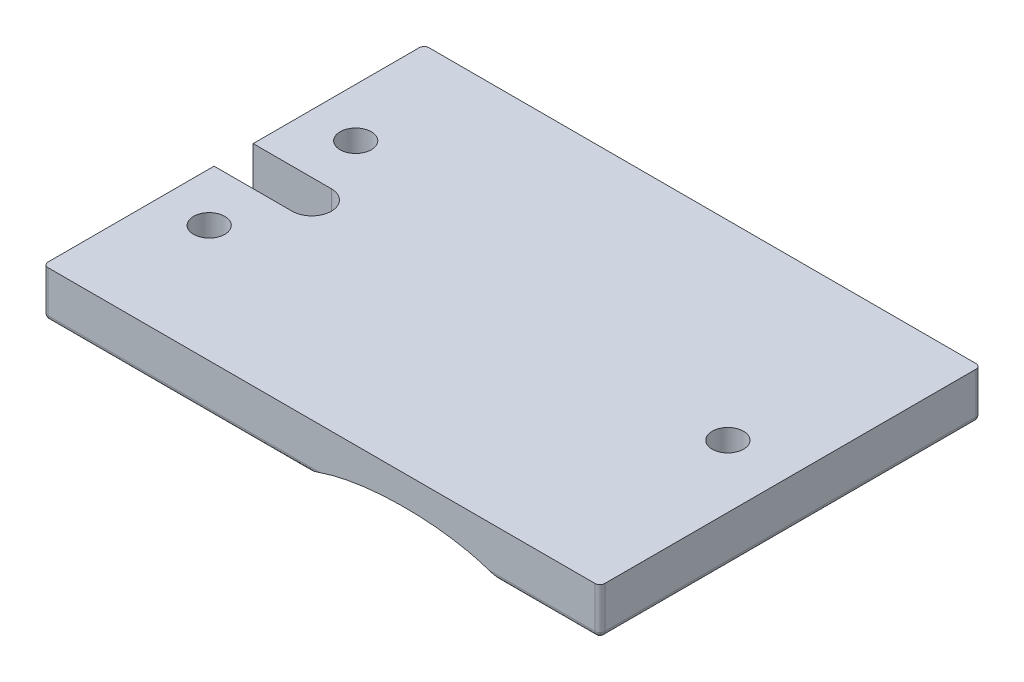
SolidWorks part; units mm, degrees
ref_plane "Front Plane" through (0, 0, 0) normal (0, 0, 1) x (1, 0, 0)
ref_plane "Top Plane" through (0, 0, 0) normal (0, 1, 0) x (1, 0, 0)
ref_plane "Right Plane" through (0, 0, 0) normal (1, 0, 0) x (0, 0, -1)
sketch "Sketch1" plane through (0, 0, 0) normal (0, 1, 0) x (1, 0, 0)
  line L1 (-43.7317, 5.792) -> (13.2683, 5.792)
  line L2 (-43.7317, 5.792) -> (-43.7317, -33.208)
  line L3 (-43.7317, -33.208) -> (13.2683, -33.208)
  line L4 (13.2683, 5.792) -> (13.2683, -33.208)
  dimension "D1" = 57
  dimension "D2" = 39
extrude "Boss-Extrude1" add sketch "Sketch1" along normal blind 4.75
sketch "Sketch6" plane through (0, 0, -5.792) normal (0, 0, -1) x (-1, 0, 0)
  line L2 (43.7317, 4.75) -> (-13.2683, 4.75) construction
  line L4 (43.7317, 4.75) -> (43.7317, 0) construction
  line L5 (19.2317, -2.75) -> (-5.7683, -2.75)
  ellipse E0 centre (6.7317, -2.75) end of major axis (19.2317, -2.75) minor radius 4.5 (19.2317, -2.75) -> (-5.7683, -2.75) ccw
  dimension "D2" = 37
  dimension "D1" = 7.5
  dimension "D3" = 25
  dimension "D4" = 9
extrude "Cut-Extrude4" cut sketch "Sketch6" against normal through all
sketch "Sketch8" plane through (0, 4.75, 0) normal (0, 1, 0) x (1, 0, 0)
  line L1 (13.2683, -13.708) -> (-43.7317, -13.708) construction
  line L2 (13.2683, -33.208) -> (13.2683, 5.792) construction
  line L4 (-43.7317, 5.792) -> (-43.7317, -33.208) construction
  line L7 (-35.7317, -11.708) -> (-43.7317, -11.708)
  line L8 (-35.7317, -11.708) -> (-35.7317, -15.708)
  line L9 (-35.7317, -15.708) -> (-43.7317, -15.708)
  line L10 (-43.7317, -11.708) -> (-43.7317, -15.708)
  line L11 (-35.7317, -11.708) -> (-43.7317, -15.708) construction
  line L12 (-35.7317, -15.708) -> (-43.7317, -11.708) construction
  arc A0 (-35.7317, -15.708) -> (-35.7317, -11.708) centre (-35.7317, -13.708) ccw
  point P6 (-39.7317, -13.708)
  dimension "D2" = 4
  dimension "D1" = 8
fillet "Fillet3" radius 0.5 12 edges at (13.2683, 0, 13.708) (13.2683, 2.375, 33.208) (8.2155, 0, 33.208) (-30.1788, 0, 33.208) (13.2683, 2.375, -5.792) (8.2155, 0, -5.792) (-30.1788, 0, -5.792) (-43.7317, 2.375, 33.208) (-43.7317, 0, 13.708) (-43.7317, 2.375, -5.792) (-16.626, 0, 13.708) (3.1626, 0, 13.708)
hole_wizard "CSK for M3 Countersunk Flat Head Screw1" positions "Sketch16" profile "Sketch15" countersink size "M3" standard "ISO"
sketch "Sketch16" plane through (0, 0, 0) normal (0, -1, 0) x (-1, 0, 0)
  line L0 (-12.7683, -13.708) -> (43.2317, -13.708) construction
  line L1 (-12.7683, 5.292) -> (-12.7683, -32.708) construction
  line L2 (43.2317, -32.708) -> (43.2317, 5.292) construction
  line L4 (-1.9141, -33.208) -> (-12.7683, -33.208) construction
  line L5 (43.7317, 5.292) -> (43.7317, -32.708) construction
  line L6 (-13.2683, -32.708) -> (-13.2683, 5.292) construction
  line L7 (15.3774, 5.792) -> (43.2317, 5.792) construction
  point P0 (-6.8683, -13.708)
  point P2 (38.7317, -21.208)
  point P14 (38.7317, -6.208)
  dimension "D1" = 19.5
  dimension "D2" = 15
  dimension "D3" = 5
  dimension "D4" = 6.4
sketch "Sketch15" plane through (6.8683, 0, 13.708) normal (1, 0, 0) x (0, 0, -1)
  line L0 (0, 0) -> (0, 4.75)
  line L1 (0, 4.75) -> (1.6, 4.75)
  line L2 (1.6, 4.75) -> (1.6, 1.55)
  line L3 (1.6, 1.55) -> (3.15, 0)
  line L5 (3.15, 0) -> (0, 0)
  line L6 (-1.6, 1.55) -> (-3.15, 0) construction
  line L11 (0, -6.35) -> (0, 107.95) construction
  dimension "Thru Hole Dia." = 3.2
  dimension "Thru Hole Depth" = 4.75
  dimension "Near C'Sink Dia." = 6.3
  dimension "Near C'Sink Angle" = 90
extrude "Cut-Extrude5" cut sketch "Sketch8" against normal through all contours L9 L8 L7 M6 | L8 A0
